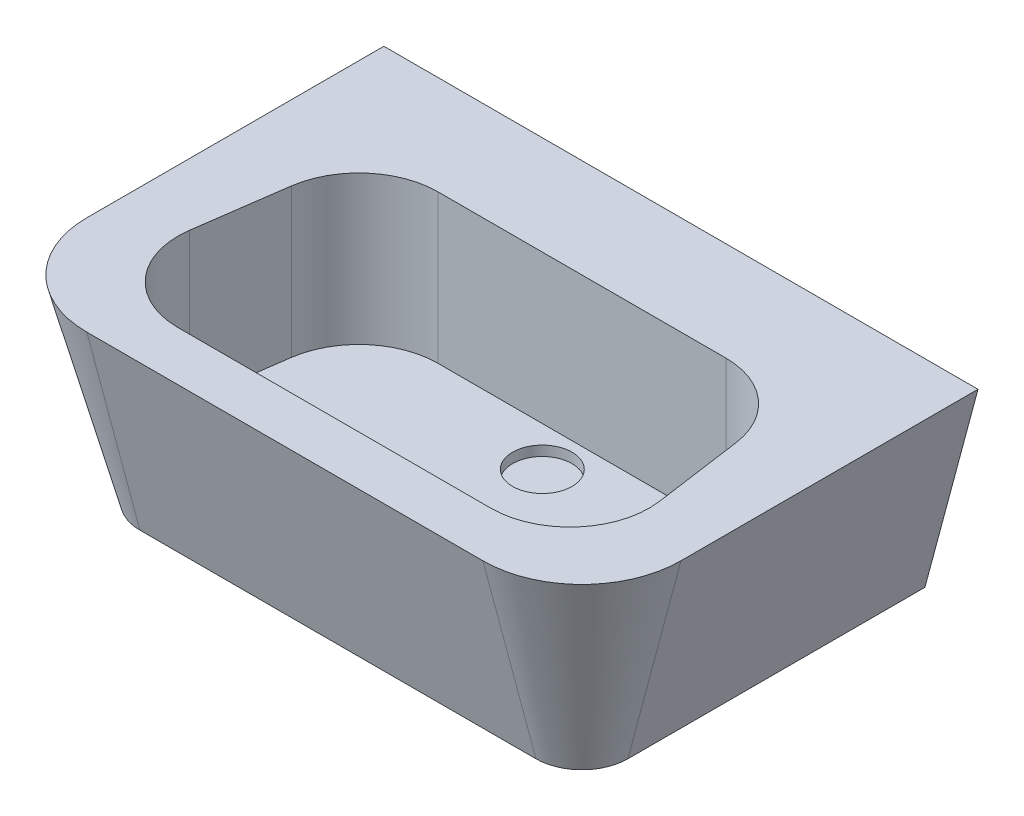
SolidWorks part; units mm, degrees
ref_plane "Plan de face" through (0, 0, 0) normal (0, 0, 1) x (1, 0, 0)
ref_plane "Plan de dessus" through (0, 0, 0) normal (0, 1, 0) x (1, 0, 0)
ref_plane "Plan de droite" through (0, 0, 0) normal (1, 0, 0) x (0, 0, -1)
sketch "Esquisse1" plane through (0, 0, 0) normal (0, 1, 0) x (1, 0, 0)
  line L1 (0, 0) -> (600, 0)
  line L2 (0, 0) -> (0, 400)
  line L3 (0, 400) -> (600, 400)
  line L4 (600, 0) -> (600, 400)
  dimension "D1" = 600
  dimension "D2" = 400
extrude "Boss.-Extru.1" add sketch "Esquisse1" along normal blind 200
fillet "Congé1" radius 100 2 edges at (600, 100, 0) (0, 100, 0)
sketch "Esquisse2" plane through (0, 200, 0) normal (0, 1, 0) x (1, 0, 0)
  line L0 (0, 400) -> (0, 100) construction
  line L1 (85.1352, 300) -> (514.8648, 300)
  line L2 (600, 100) -> (600, 400) construction
  line L3 (50, 50) -> (550, 50)
  line L6 (100, 0) -> (500, 0) construction
  line L7 (600, 400) -> (0, 400) construction
  line L8 (50, 50) -> (85.1352, 300)
  line L9 (550, 50) -> (514.8648, 300)
  dimension "D1" = 50
  dimension "D2" = 50
  dimension "D3" = 50
  dimension "D4" = 100
  dimension "D5" = 8
  dimension "D6" = 8
extrude "Enlèv. mat.-Extru.1" cut sketch "Esquisse2" against normal blind 150
fillet "Congé2" radius 80 4 edges at (550, 125, -50) (50, 125, -50) (514.8648, 125, -300) (85.1352, 125, -300)
sketch "Esquisse3" plane through (0, 50, 0) normal (0, 1, 0) x (1, 0, 0)
  line L0 (0, 400) -> (0, 100) construction
  line L1 (600, 400) -> (0, 400) construction
  circle A0 centre (300, 260) radius 30
  dimension "D1" = 60
  dimension "D3" = 140
  dimension "D2" = 300
extrude "Enlèv. mat.-Extru.2" cut sketch "Esquisse3" against normal blind 10
draft "Dépouille1" type of draft neutral plane draft angle 15 faces to draft 5 parameters "D1"=15
